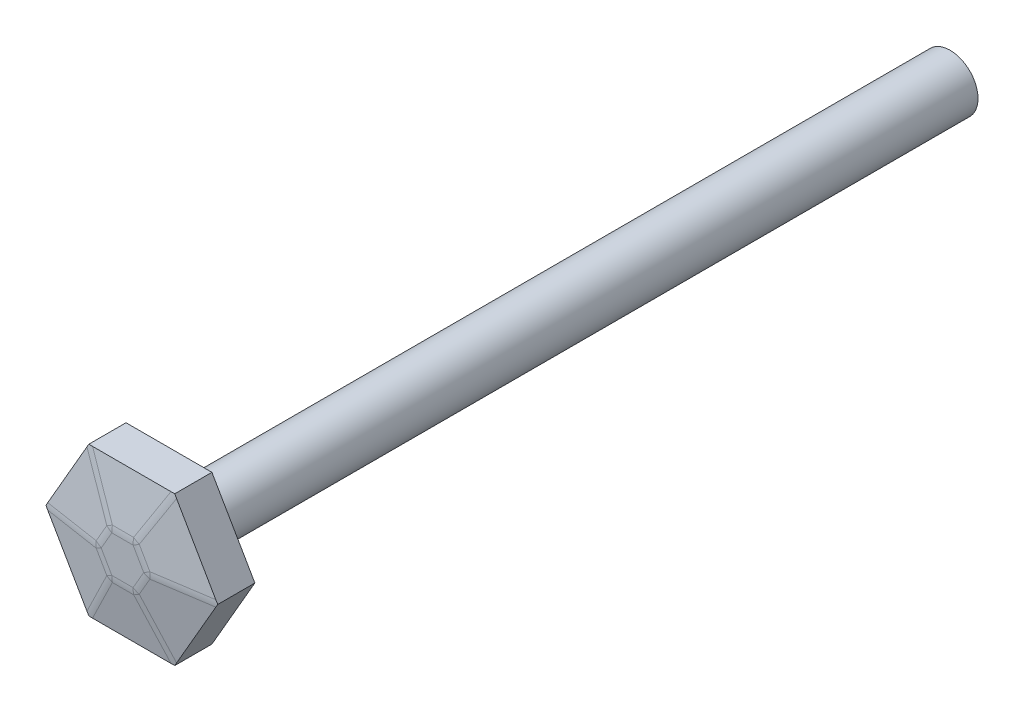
SolidWorks part; units mm, degrees
ref_plane "Front Plane" through (0, 0, 0) normal (0, 0, 1) x (1, 0, 0)
ref_plane "Top Plane" through (0, 0, 0) normal (0, 1, 0) x (1, 0, 0)
ref_plane "Right Plane" through (0, 0, 0) normal (1, 0, 0) x (0, 0, -1)
sketch "Sketch1" plane through (0, 0, 0) normal (0, 0, 1) x (1, 0, 0)
  circle A0 centre (0, 0) radius 1.905
  dimension "D1" = 3.81
extrude "Boss-Extrude1" add sketch "Sketch1" along normal blind 53.34
sketch "Sketch2" plane through (0, 0, 53.34) normal (0, 0, 1) x (1, 0, 0)
  line L1 (5.8659, 0) -> (2.9329, 5.08)
  line L2 (2.9329, 5.08) -> (-2.9329, 5.08)
  line L3 (-2.9329, 5.08) -> (-5.8659, 0)
  line L4 (-5.8659, 0) -> (-2.9329, -5.08)
  line L5 (-2.9329, -5.08) -> (2.9329, -5.08)
  line L6 (2.9329, -5.08) -> (5.8659, 0)
  circle A0 centre (0, 0) radius 5.08 construction
  dimension "D1" = 10.16
extrude "Boss-Extrude2" add sketch "Sketch2" along normal blind 3.175
chamfer "Chamfer1" distance 0.635 angle 80 6 edges at (4.3994, -2.54, 56.515) (0, -5.08, 56.515) (-4.3994, -2.54, 56.515) (-4.3994, 2.54, 56.515) (0, 5.08, 56.515) (4.3994, 2.54, 56.515)
fillet "Fillet1" radius 2.54 12 edges at (-1.2806, -0.7394, 56.515) (-1.2806, 0.7394, 56.515) (0, 1.4787, 56.515) (1.2806, 0.7394, 56.515) (1.2806, -0.7394, 56.515) (0, -1.4787, 56.515) (1.8933, 3.2794, 56.1975) (3.7867, 0, 56.1975) (1.8933, -3.2794, 56.1975) (-1.8933, -3.2794, 56.1975) (-3.7867, 0, 56.1975) (-1.8933, 3.2794, 56.1975)
